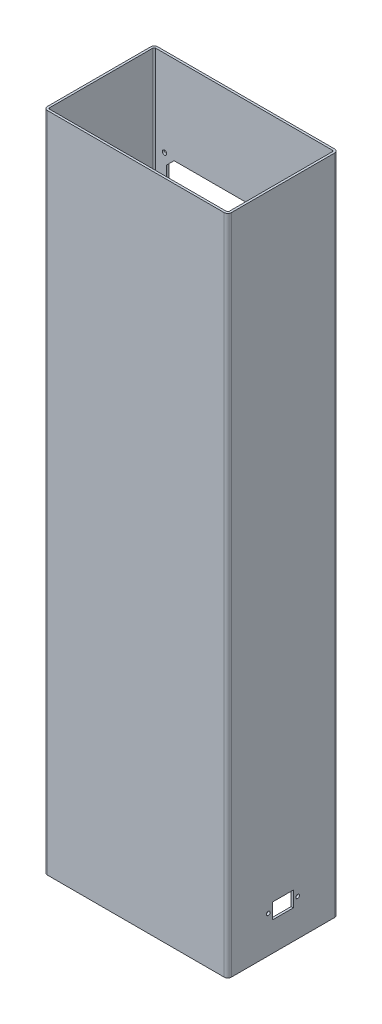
SolidWorks part; units mm, degrees
ref_plane "Plan1" through (0, 0, 0) normal (0, 0, 1) x (1, 0, 0)
ref_plane "Plan2" through (0, 0, 0) normal (0, 1, 0) x (1, 0, 0)
ref_plane "Plan3" through (0, 0, 0) normal (1, 0, 0) x (0, 0, -1)
sketch "Esquisse1" plane through (0, 0, 0) normal (0, 1, 0) x (1, 0, 0)
  line L1 (0, 0) -> (250, 0)
  line L2 (0, 0) -> (0, 150)
  line L3 (0, 150) -> (250, 150)
  line L4 (250, 0) -> (250, 150)
extrude "Base-Extrusion" add sketch "Esquisse1" along normal blind 900
fillet "Congé2" radius 5
shell "Coque1" thickness 3
sketch "Esquisse3" plane through (0, 0, -150) normal (0, 0, -1) x (-1, 0, 0)
  line L0 (-230, 770) -> (-220, 780)
  line L1 (-220, 780) -> (-30, 780)
  line L2 (-230, 770) -> (-230, 460)
  line L3 (-220, 450) -> (-30, 450)
  line L4 (-20, 770) -> (-20, 460)
  line L5 (-30, 780) -> (-20, 770)
  line L6 (-20, 460) -> (-30, 450)
  line L7 (-220, 450) -> (-230, 460)
extrude "Enlèv. mat.-Extru.2" cut sketch "Esquisse3" against normal blind 10
sketch "Esquisse4" plane through (0, 0, -150) normal (0, 0, -1) x (-1, 0, 0)
  circle A0 centre (-17, 783) radius 3
  circle A1 centre (-17, 447) radius 3
  circle A2 centre (-233, 783) radius 3
  circle A3 centre (-233, 447) radius 3
extrude "Enlèv. mat.-Extru.3" cut sketch "Esquisse4" against normal blind 10
sketch "Esquisse6" plane through (250, 0, 0) normal (1, 0, 0) x (0, 0, -1)
  line L1 (61, 60.5) -> (89, 60.5)
  line L2 (61, 60.5) -> (61, 39.5)
  line L3 (61, 39.5) -> (89, 39.5)
  line L4 (89, 60.5) -> (89, 39.5)
  circle A0 centre (95, 50) radius 2.5
  circle A1 centre (55, 50) radius 2.5
extrude "Enlèv. mat.-Extru.4" cut sketch "Esquisse6" against normal blind 8
